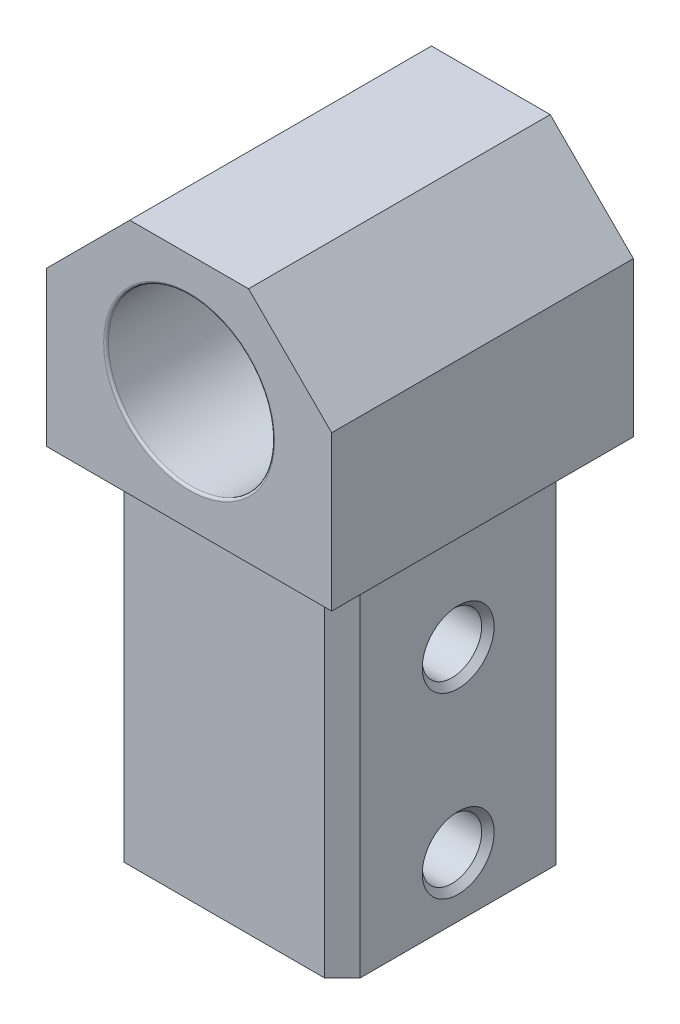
SolidWorks part; units mm, degrees
ref_plane "Front Plane" through (0, 0, 0) normal (0, 0, 1) x (1, 0, 0)
ref_plane "Top Plane" through (0, 0, 0) normal (0, 1, 0) x (1, 0, 0)
ref_plane "Right Plane" through (0, 0, 0) normal (1, 0, 0) x (0, 0, -1)
sketch "Esquisse1" plane through (0, 0, 0) normal (0, 1, 0) x (1, 0, 0)
  line L1 (-9.95, 9.75) -> (9.95, 9.75)
  line L2 (-9.95, 9.75) -> (-9.95, -9.75)
  line L3 (-9.95, -9.75) -> (9.95, -9.75)
  line L4 (9.95, 9.75) -> (9.95, -9.75)
  line L5 (-9.95, 9.75) -> (9.95, -9.75) construction
  line L6 (-9.95, -9.75) -> (9.95, 9.75) construction
  point P0 (0, 0)
  dimension "D1" = 19.9
  dimension "D2" = 19.5
extrude "Boss.-Extru.1" add sketch "Esquisse1" against normal blind 30
sketch "Esquisse3" plane through (0, 0, 0) normal (0, 1, 0) x (1, 0, 0)
  line L0 (-12, 12.7) -> (-12, -12.7)
  line L1 (-12, -12.7) -> (12, -12.7)
  line L2 (12, -12.7) -> (12, 12.7)
  line L3 (12, 12.7) -> (-12, 12.7)
  line L4 (0, 11.7173) -> (0, -11.7173) construction
  line L5 (0, 0) -> (17.8395, 0) construction
  point P7 (12, 0)
  point P10 (0, 0)
  point P11 (0, 12.7)
  dimension "D1" = 24
  dimension "D3" = 25.4
  dimension "D4" = 12.7
extrude "Boss.-Extru.2" add sketch "Esquisse3" along normal blind 20
hole_wizard "Trou taraudé M61" positions "Esquisse9" profile "Esquisse10" tap size "M6" standard "ISO"
sketch "Esquisse9" plane through (9.95, 0, 0) normal (1, 0, 0) x (0, 0, -1)
  line L1 (0, 0) -> (0, -29.8982) construction
  line L2 (9.75, -30) -> (-9.75, -30) construction
  circle A0 centre (0, -10) radius 5.25 construction
  circle A1 centre (0, -25) radius 5.25 construction
  point P0 (0, -10)
  point P2 (0, -25)
  dimension "D3" = 10.5
  dimension "D4" = 10.5
  dimension "D1" = 10
  dimension "D2" = 15
  dimension "D5" = 5
sketch "Esquisse10" plane through (9.95, -10, 0) normal (0, 1, 0) x (0, 0, -1)
  line L0 (0, 0) -> (0, 19.9)
  line L1 (0, 19.9) -> (3.025, 19.9)
  line L2 (2.5, 19.375) -> (2.5, 0.525)
  line L3 (2.5, 0.525) -> (3.025, 0)
  line L5 (3.025, 0) -> (0, 0)
  line L6 (-2.5, 0.525) -> (-3.025, 0) construction
  line L7 (3.025, 19.9) -> (2.5, 19.375)
  line L8 (-3.025, 19.9) -> (-2.5, 19.375) construction
  line L11 (0, -6.35) -> (0, 107.95) construction
  dimension "Diamètre du trou pour taraudage jusqu'au prochain" = 5
  dimension "Profondeur du trou pour taraudage jusqu'au prochain" = 19.9
  dimension "Diamètre du fraisage entrant" = 6.05
  dimension "Angle du fraisage entrant" = 90
  dimension "Diamètre du fraisage débouchant" = 6.05
  dimension "Angle du fraisage débouchant" = 90
chamfer "Chanfrein5" distance 1.5 angle 45 4 edges at (9.95, -15, -9.75) (9.95, -15, 9.75) (-9.95, -15, 9.75) (-9.95, -15, -9.75)
sketch "Esquisse16" plane through (0, 0, 12.7) normal (0, 0, 1) x (1, 0, 0)
  line L0 (0, 0) -> (0, 20) construction
  line L1 (-12, 20) -> (12, 20) construction
  circle A0 centre (0, 10) radius 7
  dimension "D1" = 14
extrude "Enlèv. mat.-Extru.1" cut sketch "Esquisse16" against normal through all
fillet "Congé1" radius 0.2 2 edges at (7, 10, -12.7) (7, 10, 12.7)
chamfer "Chanfrein6" distance 7 angle 45 2 edges at (-12, 20, 0) (12, 20, 0)
